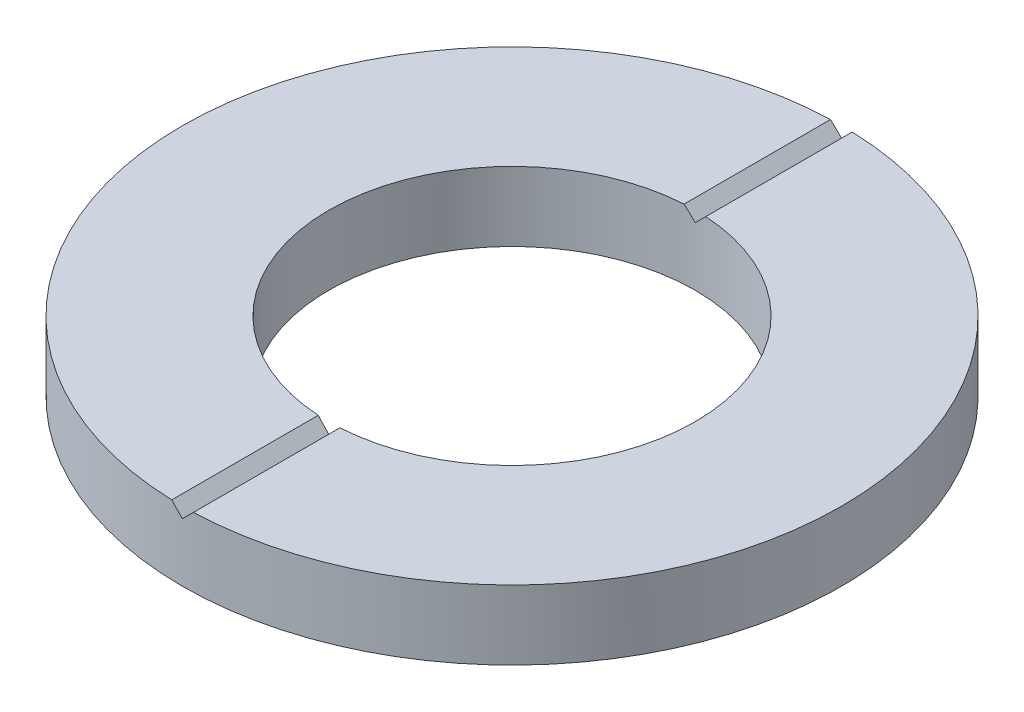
SolidWorks part; units mm, degrees
ref_plane "FRONT" through (0, 0, 0) normal (0, 0, 1) x (1, 0, 0)
ref_plane "TOP" through (0, 0, 0) normal (0, 1, 0) x (1, 0, 0)
ref_plane "RIGHT" through (0, 0, 0) normal (1, 0, 0) x (0, 0, -1)
sketch "Sketch1" plane through (0, 0, 0) normal (0, 1, 0) x (1, 0, 0)
  circle A0 centre (0, 0) radius 2.1463
  circle A1 centre (0, 0) radius 3.8608
  dimension "D1" = 4.2926
  dimension "D2" = 7.7216
extrude "Base-Extrude" add sketch "Sketch1" along normal blind 0.8128
sketch "Sketch2" plane through (0, 0, 0) normal (0, 0, 1) x (1, 0, 0)
  line L0 (-0.127, 0.8128) -> (0, 0.6858)
  line L1 (3.8608, 0.8128) -> (-3.8608, 0.8128) construction
  line L2 (0, 0.6858) -> (0.127, 0.8128)
  line L3 (0.127, 0.8128) -> (-0.127, 0.8128)
  dimension "D1" = 0.127
extrude "Extrude1" cut sketch "Sketch2" against normal through all and the other way through all
